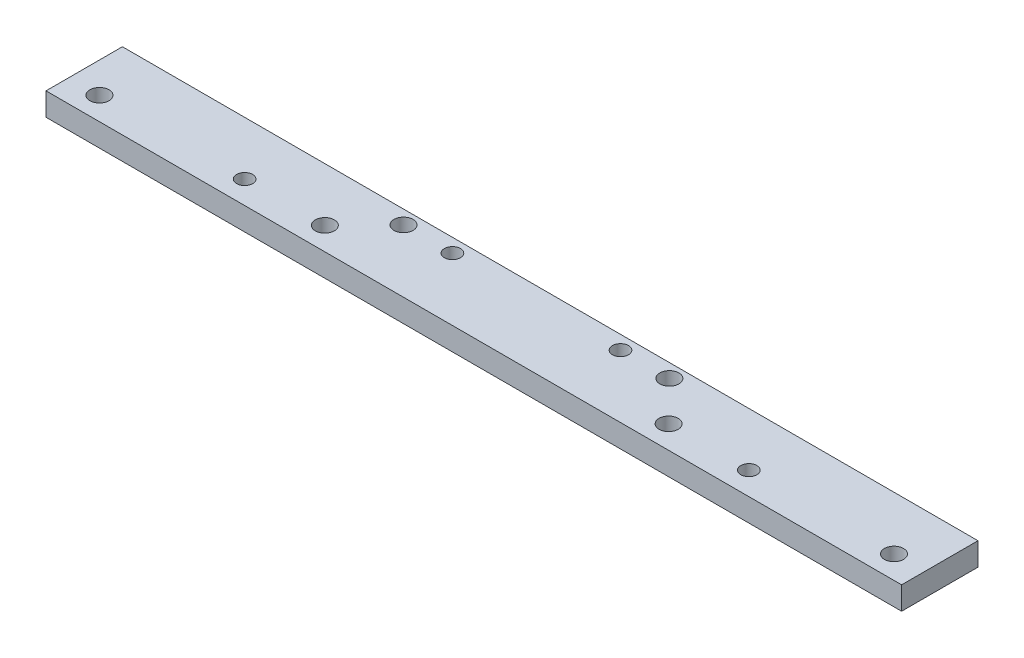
SolidWorks part; units mm, degrees
ref_plane "Plan de face" through (0, 0, 0) normal (0, 0, 1) x (1, 0, 0)
ref_plane "Plan de dessus" through (0, 0, 0) normal (0, 1, 0) x (1, 0, 0)
ref_plane "Plan de droite" through (0, 0, 0) normal (1, 0, 0) x (0, 0, -1)
sketch "Esquisse1" plane through (0, 0, 0) normal (1, 0, 0) x (0, 0, -1)
  line L1 (-25, 15) -> (25, 15)
  line L2 (-25, 15) -> (-25, 0)
  line L3 (-25, 0) -> (25, 0)
  line L4 (25, 15) -> (25, 0)
  dimension "D1" = 50
  dimension "D2" = 15
extrude "Extrusion1" add sketch "Esquisse1" along normal mid plane 560
sketch "Esquisse3" plane through (0, 15, 0) normal (0, 1, 0) x (-1, 0, 0)
  line L0 (0, -58.0584) -> (0, 58.0584) construction
  line L1 (-280, -25) -> (280, -25) construction
  circle A0 centre (-55, -16) radius 5.25
  circle A1 centre (55, -16) radius 5.25
  circle A2 centre (-87, -16) radius 6.25
  circle A3 centre (87, -16) radius 6.25
  circle A4 centre (-112.5, 10) radius 6.25
  circle A5 centre (112.5, 10) radius 6.25
  circle A6 centre (-165, 10) radius 5.25
  circle A7 centre (165, 10) radius 5.25
  circle A8 centre (-260, 10) radius 6.25
  circle A9 centre (260, 10) radius 6.25
  dimension "D4" = 12.5
  dimension "D5" = 10.5
  dimension "D9" = 12.5
  dimension "D11" = 10.5
  dimension "D1" = 110
  dimension "D2" = 9
  dimension "D3" = 174
  dimension "D6" = 225
  dimension "D7" = 330
  dimension "D8" = 520
  dimension "D10" = 35
extrude "Enlèv. mat.-Extru.1" cut sketch "Esquisse3" against normal up to next
